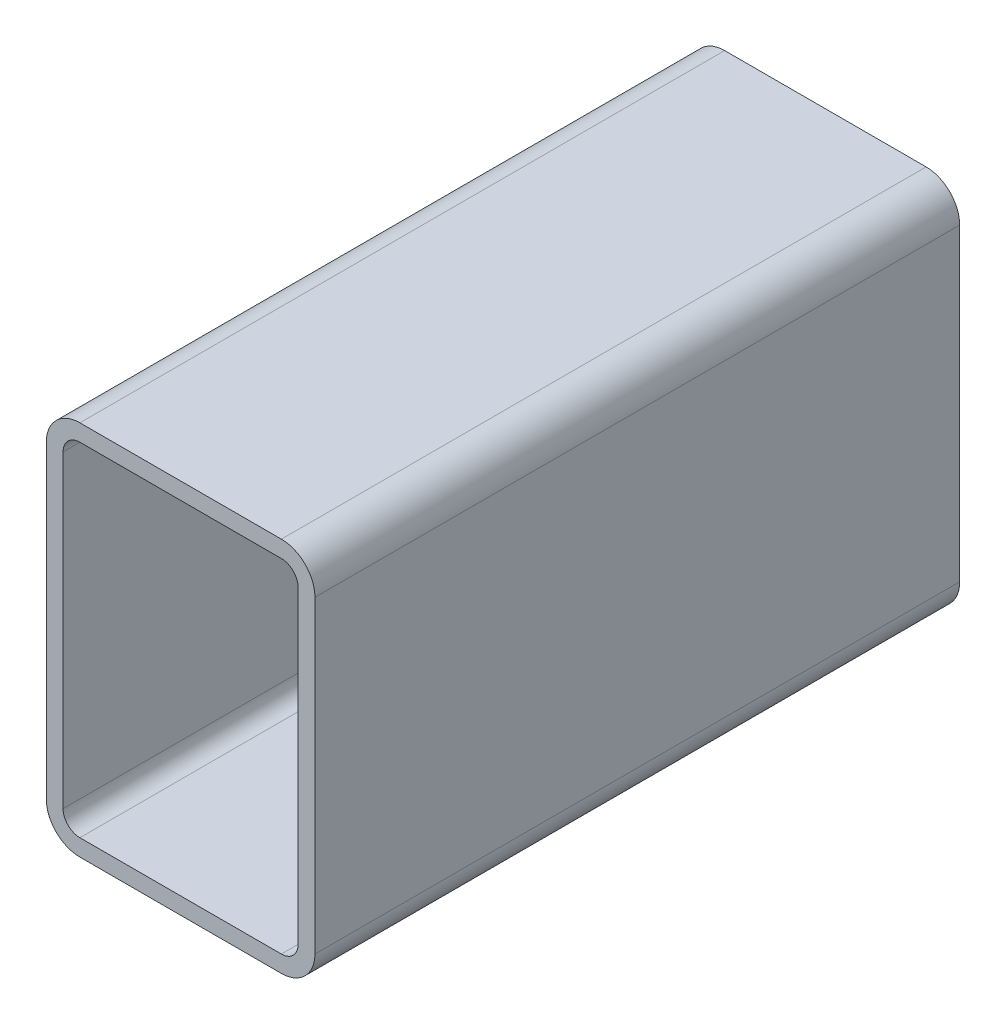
SolidWorks part; units mm, degrees
ref_plane "Front Plane" through (0, 0, 0) normal (0, 0, 1) x (1, 0, 0)
ref_plane "Top Plane" through (0, 0, 0) normal (0, 1, 0) x (1, 0, 0)
ref_plane "Right Plane" through (0, 0, 0) normal (1, 0, 0) x (0, 0, -1)
sketch "Sketch1" plane through (0, 0, 0) normal (0, 0, 1) x (1, 0, 0)
sketch_block_instance "HSS7x5x0.3125-1"
sketch_block "HSS7x5x0.3125"
extrude "Boss-Extrude1" add sketch "Sketch1" along normal blind 304.8
